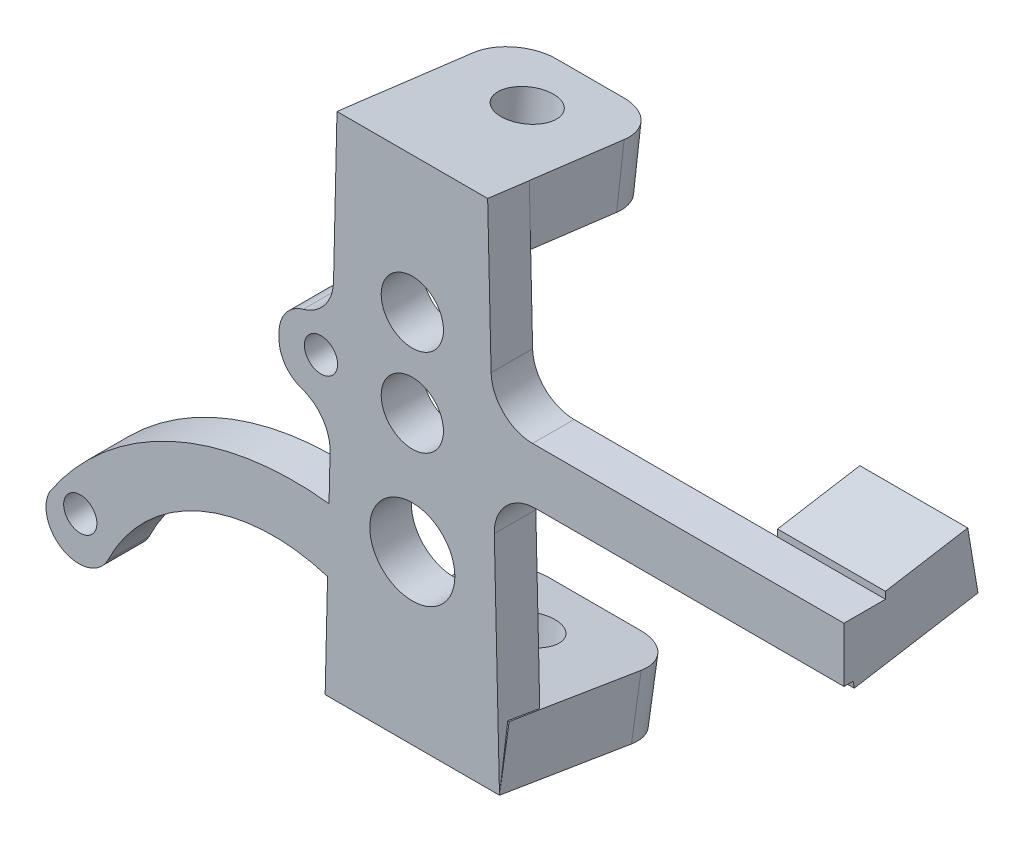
SolidWorks part; units mm, degrees
ref_plane "Front Plane" through (0, 0, 0) normal (0, 0, 1) x (1, 0, 0)
ref_plane "Top Plane" through (0, 0, 0) normal (0, 1, 0) x (1, 0, 0)
ref_plane "Right Plane" through (0, 0, 0) normal (1, 0, 0) x (0, 0, -1)
sketch "Sketch2" plane through (0, 0, 0) normal (0, 0, 1) x (1, 0, 0)
  circle A0 centre (0, 0) radius 10.25
  dimension "D1" = 20.5
extrude "Boss-Extrude2" add sketch "Sketch2" along normal blind 80.8
sketch "Sketch3" plane through (0, 0, 0) normal (0, 0, 1) x (1, 0, 0)
  line L0 (0, 0) -> (0, -45.82)
  line L1 (0, -45.82) -> (22.4883, -45.82)
  line L3 (0, 0) -> (0, 82.8)
  line L4 (-29.8361, 82.8) -> (0, 82.8)
  dimension "D1" = 45.82
  dimension "D2" = 82.8
sketch "Sketch4" plane through (0, 0, 0) normal (1, 0, 0) x (0, 0, -1)
  line L2 (0, 0) -> (0, -45.82) construction
  line L3 (0, -40.3) -> (31.8, -45.5)
  point P0 (0, 0)
  dimension "D1" = 5.2
extrude "Extrude-Thin1" add sketch "Sketch4" along normal mid plane 42 separate body thin
sketch "Sketch6" plane through (0, 0, 0) normal (1, 0, 0) x (0, 0, -1)
  line L0 (0, 82.8) -> (42.8023, 77.4)
extrude "Extrude-Thin2" add sketch "Sketch6" along normal mid plane 36.3 separate body thin
sketch "Sketch8" plane through (0, 0, 0) normal (0, 0, 1) x (1, 0, 0)
  line L0 (0, 0) -> (-80, 0)
  line L1 (-80, 0) -> (-80, -32.1)
  line L2 (0, 0) -> (91, 0)
  line L3 (91, 0) -> (91, 37.1)
  line L4 (0, -67.9813) -> (0, 67.9813) construction
  dimension "D1" = 80
  dimension "D2" = 32.1
  dimension "D3" = 91
  dimension "D4" = 37.1
sketch3d "3DSketch1"
  line L0 (91, 42.0701, -29.8207) -> (91, 27.2742, -32.2866)
  line L1 (91, 27.2742, -32.2866) -> (91, 22.3041, -2.466)
  line L2 (91, 42.0701, -29.8207) -> (91, 37.1, 0)
  line L3 (91, 22.3041, -2.466) -> (91, 37.1, 0)
  dimension "D1" = 15
  dimension "D3" = 30.232
  dimension "D2" = 90
extrude "Boss-Extrude5" add sketch "3DSketch1" along direction (-1, 0, 0) on the side of the normal mid plane 26 separate body
sketch "Sketch9" plane through (0, 0, 0) normal (0, 0, 1) x (1, 0, 0)
  line L0 (-18.15, 82.8) -> (-21, -40.3)
  line L1 (-21, -40.3) -> (21, -40.3)
  line L2 (21, -40.3) -> (19.5137, 23.8996)
  line L3 (104, 23.8996) -> (19.5137, 23.8996)
  line L4 (104, 37.1) -> (104, 23.8996)
  line L5 (104, 37.1) -> (19.208, 37.1)
  line L6 (19.208, 37.1) -> (18.15, 82.8)
  line L7 (-19.208, 37.1) -> (-32.1085, 37.1)
  line L9 (-32.1085, 37.1) -> (-32.1085, 21.25)
  line L10 (-32.1085, 21.25) -> (-19.575, 21.25)
  line L17 (0, 0) -> (-80, 0) construction
  line L18 (18.15, 82.8) -> (-18.15, 82.8)
  circle A0 centre (-80, -32.1) radius 4
  circle A1 centre (-22, 30.1) radius 4
  arc A2 (-20.4225, -15.3552) -> (-73.3675, -38.4442) centre (-33.4818, -57.6574) ccw
  arc A3 (-20.067, 0) -> (-87.3468, -31.0875) centre (-28.5144, -70.0655) ccw
  arc A4 (-87.3468, -31.0875) -> (-73.3675, -38.4442) centre (-80.3572, -34.7659) ccw
  dimension "D1" = 8
  dimension "D4" = 8
extrude "Boss-Extrude6" add sketch "Sketch9" against normal blind 10
sketch "Sketch10" plane through (0, 0, 0) normal (0, 0, 1) x (1, 0, 0)
  circle A0 centre (0, 0) radius 10.25
extrude "Cut-Extrude2" cut sketch "Sketch10" against normal blind 10
sketch "Sketch11" plane through (0, 81.5027, -10.2825) normal (0, 0.9921, -0.1252) x (1, 0, 0)
  line L1 (23.9868, 31.8744) -> (-21.8846, 31.8744)
  line L2 (23.9868, 31.8744) -> (23.9868, -34.5954)
  line L3 (23.9868, -34.5954) -> (-21.8846, -34.5954)
  line L4 (-21.8846, 31.8744) -> (-21.8846, -34.5954)
extrude "Cut-Extrude3" cut sketch "Sketch11" along normal blind 10
sketch "Sketch12" plane through (0, 0, 0) normal (0, 0, 1) x (1, 0, 0)
  line L1 (28.6605, 63.7887) -> (-36.2312, 63.7887)
  line L2 (28.6605, 63.7887) -> (28.6605, 93.4873)
  line L3 (28.6605, 93.4873) -> (-36.2312, 93.4873)
  line L4 (-36.2312, 63.7887) -> (-36.2312, 93.4873)
extrude "Cut-Extrude4" cut sketch "Sketch12" along normal blind 10
sketch "Sketch13" plane through (0, 0, 80.8) normal (0, 0, 1) x (1, 0, 0)
  circle A0 centre (0, 0) radius 10.25
extrude "Cut-Extrude5" cut sketch "Sketch13" against normal through all
sketch "Sketch15" plane through (0, 81.5027, -10.2825) normal (0, 0.9921, -0.1252) x (1, 0, 0)
  line L1 (18.15, 1.532) -> (-18.15, 1.532) construction
  circle A0 centre (0, 17.532) radius 6.35
  dimension "D1" = 12.7
  dimension "D2" = 16
sketch "Sketch16" plane through (0, -25.0392, 4.0945) normal (0, 0.9869, -0.1614) x (1, 0, 0)
  line L0 (20.7, 14.2817) -> (-20.7, 14.2817) construction
  circle A0 centre (0, 32.6317) radius 6.35
  dimension "D1" = 12.7
  dimension "D2" = 18.35
sketch "Sketch17" plane through (0, -6.2495, -38.2183) normal (0, -0.1614, -0.9869) x (-1, 0, 0)
  line L1 (21, -25.3718) -> (-21, -25.3718)
  line L2 (21, -25.3718) -> (21, -39.7718)
  line L3 (21, -39.7718) -> (-21, -39.7718)
  line L4 (-21, -25.3718) -> (-21, -39.7718)
extrude "Boss-Extrude7" add sketch "Sketch17" along normal blind 10
extrude "Cut-Extrude6" cut sketch "Sketch16" against normal through all contours A0
extrude "Cut-Extrude8" cut sketch "Sketch15" against normal blind 20 contours A0
fillet "Fillet1" radius 10 2 edges at (18.15, 70.2566, -41.9011) (-18.15, 70.2566, -41.9011)
fillet "Fillet2" radius 10 2 edges at (-21, -40.0082, -42.8309) (21, -40.0082, -42.8309)
fillet "Fillet3" radius 10 4 edges at (19.5137, 23.8996, -5) (-19.575, 21.25, -5) (-19.208, 37.1, -5) (19.208, 37.1, -5)
fillet "Fillet4" radius 8 2 edges at (-32.1085, 21.25, -5) (-32.1085, 37.1, -5)
sketch "Sketch18" plane through (0, 0, -10) normal (0, 0, -1) x (-1, 0, 0)
  circle A0 centre (0, 49.9941) radius 7.5
  circle A1 centre (0, 28.9325) radius 7.5
  dimension "D1" = 15
  dimension "D2" = 15
extrude "Cut-Extrude9" cut sketch "Sketch18" against normal through all
sketch "Sketch19" plane through (0, 37.1, 0) normal (0, 1, 0) x (1, 0, 0)
  line L1 (78, 0) -> (106.4452, 0)
  line L2 (78, 0) -> (78, 9.995)
  line L3 (78, 9.995) -> (106.4452, 9.995)
  line L4 (106.4452, 0) -> (106.4452, 9.995)
extrude "Cut-Extrude10" cut sketch "Sketch19" along normal blind 20
equation "\"D2@Sketch16\"=(12.7mm/2)+1.2cm"
